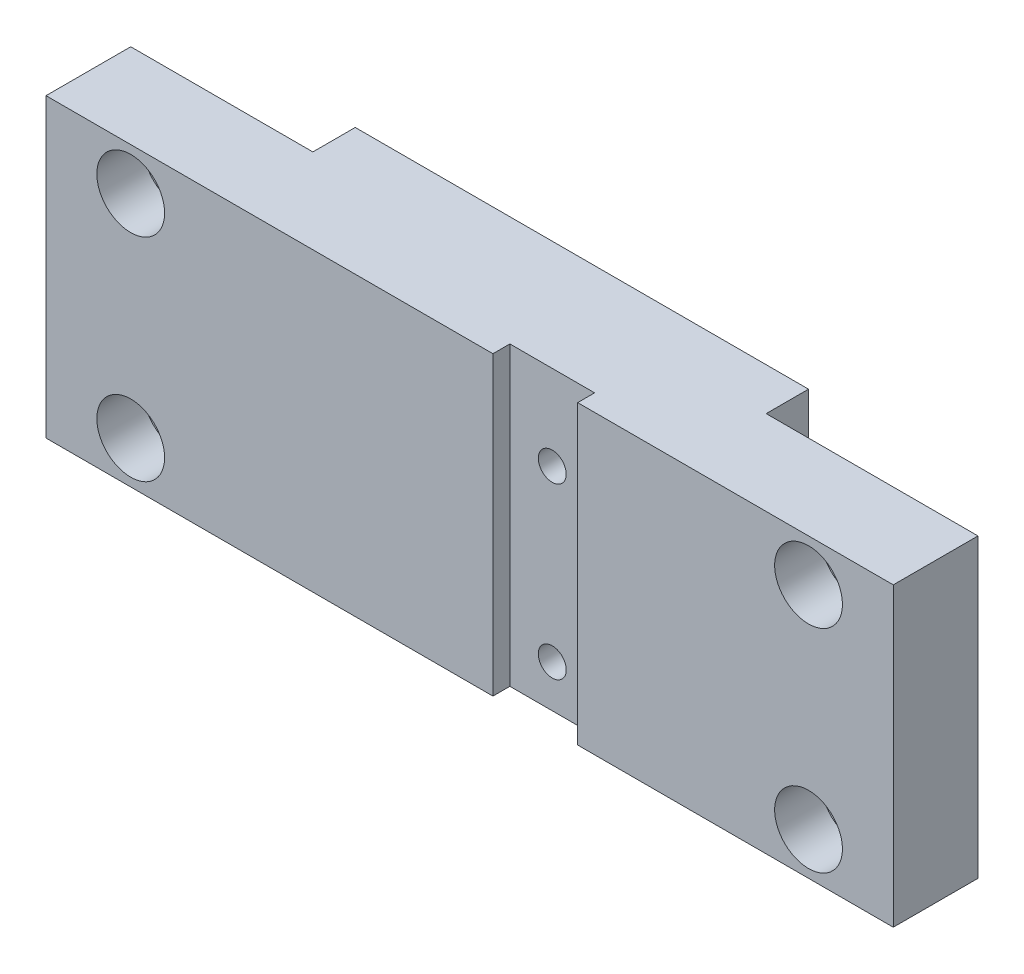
SolidWorks part; units mm, degrees
ref_plane "前视基准面" through (0, 0, 0) normal (0, 0, 1) x (1, 0, 0)
ref_plane "上视基准面" through (0, 0, 0) normal (0, 1, 0) x (1, 0, 0)
ref_plane "右视基准面" through (0, 0, 0) normal (1, 0, 0) x (0, 0, -1)
sketch "草图1" plane through (0, 0, 0) normal (0, 0, 1) x (1, 0, 0)
  line L0 (0, 35) -> (100, 35)
  line L1 (0, 0) -> (100, 0)
  line L2 (100, 0) -> (100, 35)
  line L3 (0, 0) -> (0, 35)
  circle A0 centre (10, 30) radius 2.25
  circle A1 centre (90, 30) radius 2.25
  circle A2 centre (90, 5) radius 2.25
  circle A3 centre (10, 5) radius 2.25
  circle A4 centre (57.75, 25) radius 1.65
  circle A5 centre (57.75, 5) radius 1.65
extrude "凸台-拉伸1" add sketch "草图1" along normal blind 15
sketch "草图2" plane through (0, 35, 0) normal (0, 1, 0) x (1, 0, 0)
  line L0 (0, -5) -> (21.4975, -5)
  line L1 (0, -15) -> (52.75, -15)
  line L2 (100, -15) -> (100, -5)
  line L3 (0, -15) -> (0, -5)
  line L4 (52.75, -15) -> (52.75, -13)
  line L5 (62.75, -15) -> (62.75, -13)
  line L6 (52.75, -13) -> (62.75, -13)
  line L7 (62.75, -15) -> (100, -15)
  line L8 (21.4975, -5) -> (21.4975, 0)
  line L9 (74.9975, -5) -> (74.9975, 0)
  line L10 (21.4975, 0) -> (74.9975, 0)
  line L11 (74.9975, -5) -> (100, -5)
extrude "切除-拉伸1" cut sketch "草图2" against normal through all flip side to cut
sketch "草图3" plane through (0, 0, 15) normal (0, 0, 1) x (1, 0, 0)
  circle A0 centre (10, 30) radius 4
  circle A1 centre (90, 30) radius 4
  circle A2 centre (90, 5) radius 4
  circle A3 centre (10, 5) radius 4
extrude "切除-拉伸2" cut sketch "草图3" against normal blind 5.5
